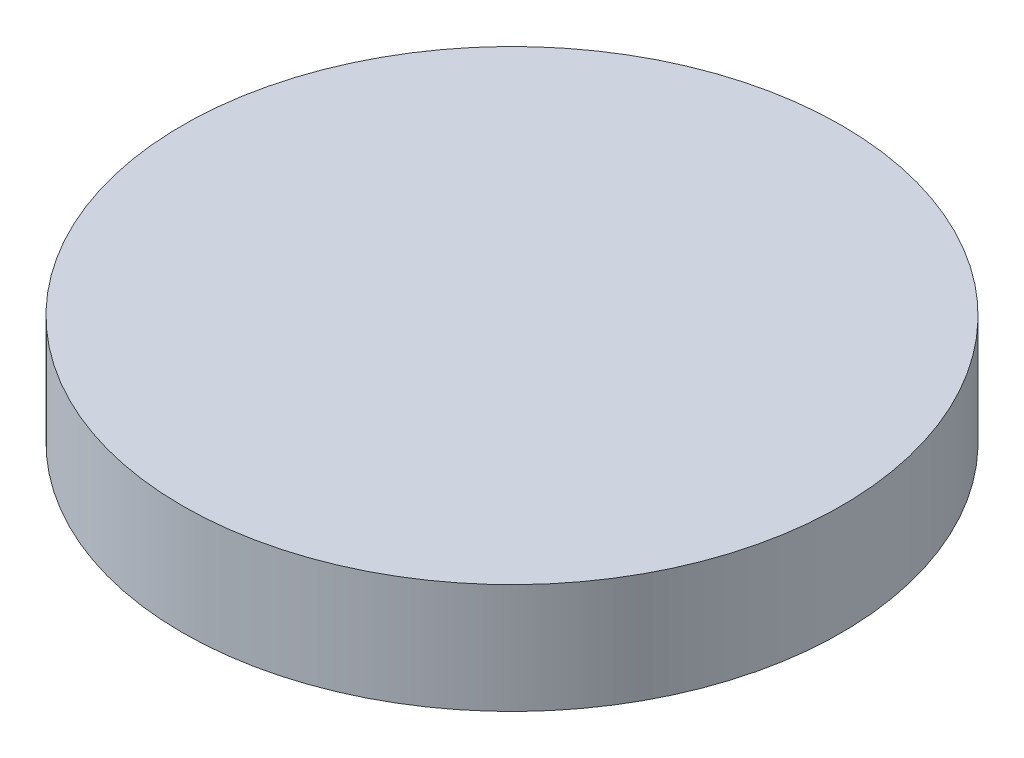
SolidWorks part; units mm, degrees
ref_plane "Front Plane" through (0, 0, 0) normal (0, 0, 1) x (1, 0, 0)
ref_plane "Top Plane" through (0, 0, 0) normal (0, 1, 0) x (1, 0, 0)
ref_plane "Right Plane" through (0, 0, 0) normal (1, 0, 0) x (0, 0, -1)
sketch "Sketch1" plane through (0, 0, 0) normal (0, 1, 0) x (1, 0, 0)
  circle A0 centre (0, 0) radius 3
extrude "Boss-Extrude1" add sketch "Sketch1" along normal blind 1 from offset 0.5 contours A0
